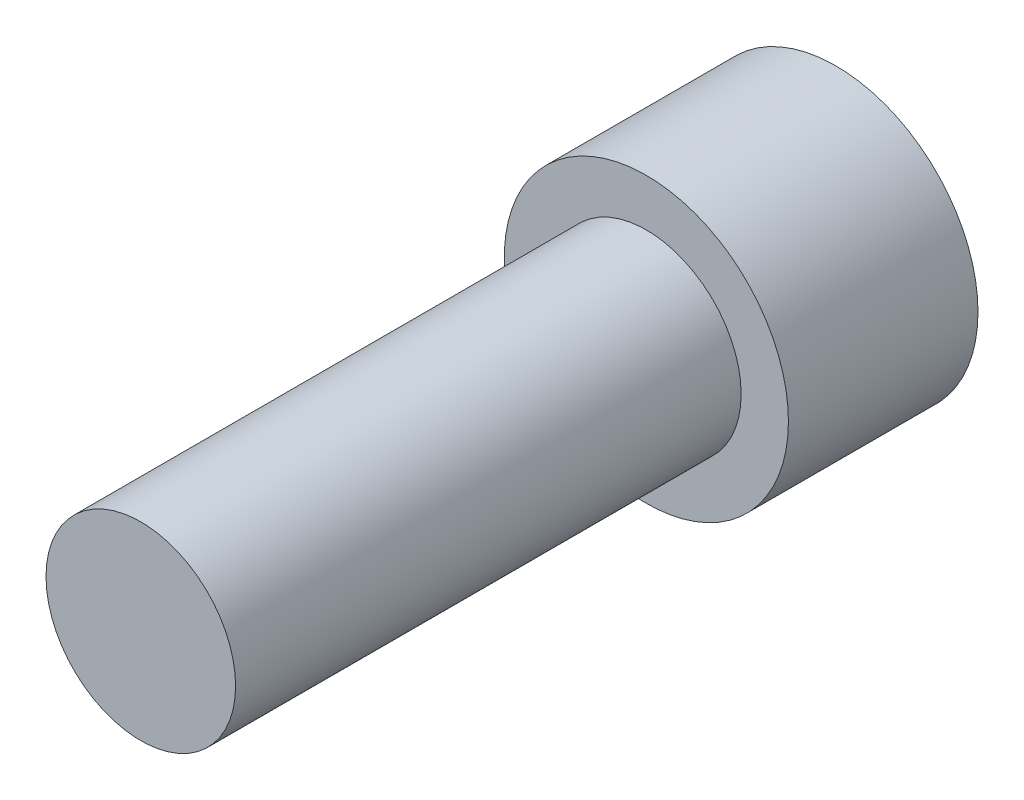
SolidWorks part; units mm, degrees
ref_plane "Front Plane" through (0, 0, 0) normal (0, 0, 1) x (1, 0, 0)
ref_plane "Top Plane" through (0, 0, 0) normal (0, 1, 0) x (1, 0, 0)
ref_plane "Right Plane" through (0, 0, 0) normal (1, 0, 0) x (0, 0, -1)
sketch "Sketch6" plane through (0, 0, 0) normal (1, 0, 0) x (0, 0, -1)
  line L0 (-25.4, 0) -> (22.525, 0) construction
  line L1 (7.8511, 0) -> (-7.8511, 0) construction
  line L2 (-25.4, 0) -> (-25.4, -4.7625)
  line L3 (-25.4, -4.7625) -> (0, -4.7625)
  line L4 (0, 7.8511) -> (0, -7.8511) construction
  line L5 (0, -4.7625) -> (0, -7.1374)
  line L6 (0, -7.1374) -> (9.525, -7.1374)
  line L7 (9.525, -7.1374) -> (9.525, 0)
  line L8 (9.525, 0) -> (-25.4, 0)
  dimension "L" = 25.4
  dimension "H" = 9.525
  dimension "A" = 14.2748
  dimension "D" = 9.525
revolve "Revolve1" add sketch "Sketch6" angle 360 about L0
sketch "Sketch7" plane through (0, 0, -9.525) normal (0, 0, -1) x (-1, 0, 0)
  line L2 (-3.9624, 2.2877) -> (-3.9624, -2.2877)
  line L4 (-3.9624, -2.2877) -> (0, -4.5754)
  line L5 (0, -4.5754) -> (3.9624, -2.2877)
  line L6 (3.9624, -2.2877) -> (3.9624, 2.2877)
  line L7 (3.9624, 2.2877) -> (0, 4.5754)
  line L8 (0, 4.5754) -> (-3.9624, 2.2877)
  circle A0 centre (0, 0) radius 3.9624 construction
  dimension "J" = 7.9248
extrude "HEX" cut sketch "Sketch7" against normal blind 5.842
